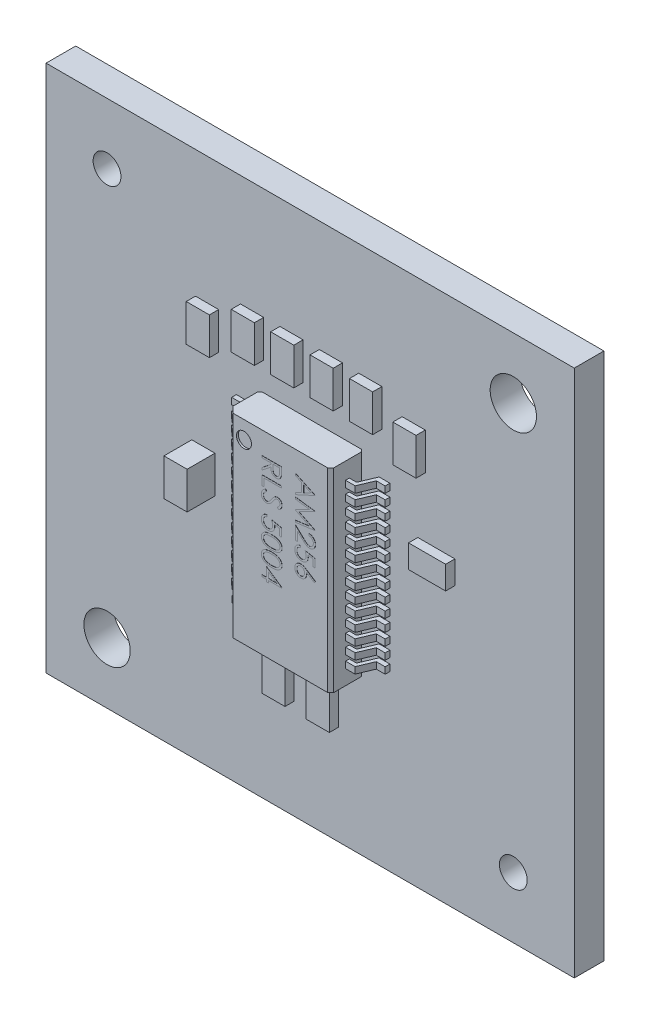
SolidWorks part; units mm, degrees
ref_plane "Plane1" through (0, 0, 0) normal (0, 0, 1) x (1, 0, 0)
ref_plane "Plane2" through (0, 0, 0) normal (0, 1, 0) x (1, 0, 0)
ref_plane "Plane3" through (0, 0, 0) normal (1, 0, 0) x (0, 0, -1)
sketch "Sketch1" plane through (0, 0, 0) normal (0, 0, 1) x (1, 0, 0)
  line L0 (7.9685, 8.8978) -> (9.3019, 8.8978)
  line L1 (7.9685, 9.7978) -> (2.3685, 9.7978)
  line L2 (7.9685, 9.7978) -> (7.9685, 8.8978)
  line L3 (7.9685, -0.7022) -> (2.3685, -0.7022)
  line L4 (2.3685, 9.7978) -> (2.3685, 8.8978)
  line L5 (7.9685, 9.7978) -> (2.3685, -0.7022) construction
  line L6 (7.9685, -0.7022) -> (2.3685, 9.7978) construction
  line L7 (1.0185, 8.8978) -> (2.3685, 8.8978)
  line L8 (1.0185, 8.8978) -> (1.0185, 8.5478)
  line L9 (1.0185, 8.5478) -> (2.3685, 8.5478)
  line L10 (2.3685, 8.5478) -> (2.3685, 8.2478)
  line L11 (7.9685, 8.5478) -> (7.9685, 8.2478)
  line L13 (9.3019, 8.8978) -> (9.3019, 8.5478)
  line L14 (7.9685, 8.5478) -> (9.3019, 8.5478)
  line L16 (7.9685, 7.8978) -> (9.3019, 7.8978)
  line L17 (9.3019, 8.2478) -> (9.3019, 7.8978)
  line L18 (7.9685, 7.5978) -> (9.3019, 7.5978)
  line L19 (7.9685, 7.2478) -> (7.9685, 6.9478)
  line L20 (7.9685, 7.2478) -> (9.3019, 7.2478)
  line L21 (9.3019, 7.5978) -> (9.3019, 7.2478)
  line L22 (7.9685, 6.9478) -> (9.3019, 6.9478)
  line L23 (7.9685, 6.5978) -> (7.9685, 6.2978)
  line L24 (7.9685, 6.5978) -> (9.3019, 6.5978)
  line L25 (9.3019, 6.9478) -> (9.3019, 6.5978)
  line L26 (7.9685, 6.2978) -> (9.3019, 6.2978)
  line L27 (7.9685, 7.8978) -> (7.9685, 7.5978)
  line L28 (7.9685, 5.9478) -> (9.3019, 5.9478)
  line L29 (9.3019, 6.2978) -> (9.3019, 5.9478)
  line L30 (7.9685, 5.6478) -> (9.3019, 5.6478)
  line L31 (7.9685, 5.2978) -> (7.9685, 4.9978)
  line L32 (7.9685, 5.2978) -> (9.3019, 5.2978)
  line L33 (9.3019, 5.6478) -> (9.3019, 5.2978)
  line L34 (7.9685, 4.9978) -> (9.3019, 4.9978)
  line L35 (7.9685, 4.6478) -> (7.9685, 4.3478)
  line L36 (7.9685, 4.6478) -> (9.3019, 4.6478)
  line L37 (9.3019, 4.9978) -> (9.3019, 4.6478)
  line L38 (7.9685, 4.3478) -> (9.3019, 4.3478)
  line L39 (7.9685, 5.9478) -> (7.9685, 5.6478)
  line L40 (7.9685, 3.9978) -> (9.3019, 3.9978)
  line L41 (9.3019, 4.3478) -> (9.3019, 3.9978)
  line L42 (7.9685, 3.6978) -> (9.3019, 3.6978)
  line L43 (7.9685, 3.3478) -> (7.9685, 3.0478)
  line L44 (7.9685, 3.3478) -> (9.3019, 3.3478)
  line L45 (9.3019, 3.6978) -> (9.3019, 3.3478)
  line L46 (7.9685, 3.0478) -> (9.3019, 3.0478)
  line L47 (7.9685, 3.9978) -> (7.9685, 3.6978)
  line L48 (7.9685, 2.6978) -> (9.3019, 2.6978)
  line L49 (9.3019, 3.0478) -> (9.3019, 2.6978)
  line L50 (7.9685, 2.3978) -> (9.3019, 2.3978)
  line L51 (7.9685, 8.2478) -> (9.3019, 8.2478)
  line L52 (7.9685, 2.0478) -> (9.3019, 2.0478)
  line L53 (9.3019, 2.3978) -> (9.3019, 2.0478)
  line L54 (7.9685, 1.7478) -> (9.3019, 1.7478)
  line L55 (7.9685, 0.7478) -> (7.9685, 0.4478)
  line L56 (7.9685, 1.3978) -> (9.3019, 1.3978)
  line L57 (9.3019, 1.7478) -> (9.3019, 1.3978)
  line L58 (7.9685, 1.0978) -> (9.3019, 1.0978)
  line L59 (7.9685, 1.3978) -> (7.9685, 1.0978)
  line L60 (7.9685, 2.0478) -> (7.9685, 1.7478)
  line L61 (9.3019, 1.0978) -> (9.3019, 0.7478)
  line L62 (7.9685, 0.4478) -> (9.3019, 0.4478)
  line L63 (7.9685, 0.0978) -> (7.9685, -0.7022)
  line L64 (7.9685, 0.0978) -> (9.3019, 0.0978)
  line L65 (9.3019, 0.4478) -> (9.3019, 0.0978)
  line L66 (1.0185, 8.2478) -> (2.3685, 8.2478)
  line L67 (1.0185, 8.2478) -> (1.0185, 7.8978)
  line L68 (1.0185, 7.8978) -> (2.3685, 7.8978)
  line L69 (2.3685, 7.8978) -> (2.3685, 7.5978)
  line L70 (1.0185, 7.5978) -> (2.3685, 7.5978)
  line L71 (1.0185, 7.5978) -> (1.0185, 7.2478)
  line L72 (1.0185, 7.2478) -> (2.3685, 7.2478)
  line L73 (2.3685, 7.2478) -> (2.3685, 6.9478)
  line L74 (1.0185, 6.9478) -> (2.3685, 6.9478)
  line L75 (1.0185, 6.9478) -> (1.0185, 6.5978)
  line L76 (1.0185, 6.5978) -> (2.3685, 6.5978)
  line L77 (2.3685, 5.9478) -> (2.3685, 5.6478)
  line L78 (1.0185, 6.2978) -> (2.3685, 6.2978)
  line L79 (1.0185, 6.2978) -> (1.0185, 5.9478)
  line L80 (1.0185, 5.9478) -> (2.3685, 5.9478)
  line L81 (2.3685, 5.2978) -> (2.3685, 4.9978)
  line L82 (1.0185, 5.6478) -> (2.3685, 5.6478)
  line L83 (1.0185, 5.6478) -> (1.0185, 5.2978)
  line L84 (1.0185, 5.2978) -> (2.3685, 5.2978)
  line L85 (2.3685, 4.6478) -> (2.3685, 4.3478)
  line L86 (1.0185, 4.9978) -> (2.3685, 4.9978)
  line L87 (1.0185, 4.9978) -> (1.0185, 4.6478)
  line L88 (1.0185, 4.6478) -> (2.3685, 4.6478)
  line L89 (2.3685, 3.9978) -> (2.3685, 3.6978)
  line L90 (1.0185, 4.3478) -> (2.3685, 4.3478)
  line L91 (1.0185, 4.3478) -> (1.0185, 3.9978)
  line L92 (1.0185, 3.9978) -> (2.3685, 3.9978)
  line L93 (2.3685, 3.3478) -> (2.3685, 3.0478)
  line L94 (1.0185, 3.6978) -> (2.3685, 3.6978)
  line L95 (1.0185, 3.6978) -> (1.0185, 3.3478)
  line L96 (1.0185, 3.3478) -> (2.3685, 3.3478)
  line L97 (2.3685, 2.6978) -> (2.3685, 2.3978)
  line L98 (1.0185, 3.0478) -> (2.3685, 3.0478)
  line L99 (1.0185, 3.0478) -> (1.0185, 2.6978)
  line L100 (1.0185, 2.6978) -> (2.3685, 2.6978)
  line L101 (2.3685, 2.0478) -> (2.3685, 1.7478)
  line L102 (1.0185, 2.3978) -> (2.3685, 2.3978)
  line L103 (1.0185, 2.3978) -> (1.0185, 2.0478)
  line L104 (1.0185, 2.0478) -> (2.3685, 2.0478)
  line L105 (2.3685, 1.3978) -> (2.3685, 1.0978)
  line L106 (1.0185, 1.7478) -> (2.3685, 1.7478)
  line L107 (1.0185, 1.7478) -> (1.0185, 1.3978)
  line L108 (1.0185, 1.3978) -> (2.3685, 1.3978)
  line L109 (2.3685, 0.0978) -> (2.3685, -0.7022)
  line L110 (1.0185, 1.0978) -> (2.3685, 1.0978)
  line L111 (1.0185, 1.0978) -> (1.0185, 0.7478)
  line L112 (1.0185, 0.7478) -> (2.3685, 0.7478)
  line L113 (7.9685, 0.7478) -> (9.3019, 0.7478)
  line L114 (1.0185, 0.4478) -> (2.3685, 0.4478)
  line L115 (1.0185, 0.4478) -> (1.0185, 0.0978)
  line L116 (1.0185, 0.0978) -> (2.3685, 0.0978)
  line L117 (7.9685, 2.6978) -> (7.9685, 2.3978)
  line L118 (2.3685, 6.5978) -> (2.3685, 6.2978)
  line L119 (2.3685, 0.7478) -> (2.3685, 0.4478)
  line L187 (7.4885, 0.4478) -> (7.4885, 0.0978)
  line L188 (7.0185, 0.7478) -> (7.1952, 0.7478)
  line L189 (7.4885, 1.0978) -> (7.4885, 1.079)
  line L190 (7.4885, 1.7478) -> (7.4885, 1.3978)
  line L191 (7.4885, 3.0478) -> (7.4885, 2.6978)
  line L192 (7.4885, 2.3978) -> (7.4885, 2.0478)
  line L193 (7.4885, 3.6978) -> (7.4885, 3.3478)
  line L194 (7.4885, 4.3478) -> (7.4885, 3.9978)
  line L195 (7.4885, 4.9978) -> (7.4885, 4.6478)
  line L196 (7.4885, 5.6478) -> (7.4885, 5.2978)
  line L197 (7.4885, 6.2978) -> (7.4885, 5.9478)
  line L198 (7.4885, 6.9478) -> (7.4885, 6.5978)
  line L199 (7.4885, 7.5978) -> (7.4885, 7.2478)
  line L200 (7.0185, 8.2478) -> (7.1418, 8.2478)
  line L201 (7.4885, 8.0165) -> (7.4885, 7.8978)
  line L202 (7.0185, 8.5478) -> (7.3018, 8.5478)
  line L203 (7.4885, 8.8978) -> (7.4885, 8.5478)
  circle A0 centre (5.1685, 4.5478) radius 0.005
  dimension "D3" = 1.35
  dimension "D1" = 5.6
  dimension "D2" = 10.5
  dimension "D4" = 0.9
  dimension "D5" = 0.35
  dimension "D6" = 2
  dimension "D7" = 14
extrude "Base-Extrude" add sketch "Sketch1" along normal blind 1.86
sketch "Sketch5" plane through (0, 0, 1.86) normal (0, 0, 1) x (1, 0, 0)
  circle A0 centre (3.2885, 8.8458) radius 0.4042
extrude "Cut-Extrude5" cut sketch "Sketch5" against normal blind 0.1
sketch "Sketch15" plane through (0, 9.7978, 0) normal (0, 1, 0) x (1, 0, 0)
  line L0 (1.0185, -0.2554) -> (1.515, -0.2554)
  line L1 (1.0185, -1.86) -> (1.0185, 0) construction
  line L2 (1.515, -0.2554) -> (1.8543, -1.0602)
  line L3 (1.8543, -1.0602) -> (2.3685, -1.0602)
  line L4 (2.3685, -1.86) -> (2.3685, 0) construction
  line L5 (1.6176, 0) -> (1.9784, -0.8559)
  line L6 (2.3685, 0) -> (1.0185, 0) construction
  line L7 (1.9784, -0.8559) -> (2.3685, -0.8559)
  line L8 (2.3685, -0.8559) -> (2.3685, -0.1875)
  line L9 (2.3685, -1.86) -> (2.3685, 0) construction
  line L10 (2.3685, -0.1875) -> (2.4855, -0.0818)
  line L11 (2.4855, -0.0818) -> (7.8515, -0.0818)
  line L13 (7.9685, -1.86) -> (2.3685, -1.86) construction
  line L14 (2.3685, -1.0602) -> (2.3685, -1.5336)
  line L15 (1.0185, -0.2554) -> (0.5525, -0.2554)
  line L16 (0.5525, -0.2554) -> (0.5525, -2.3857)
  line L17 (0.5525, -2.3857) -> (2.6512, -2.3857)
  line L18 (9.7846, -2.3857) -> (7.7471, -2.3896)
  line L19 (9.7846, -0.2554) -> (9.7846, -2.3857)
  line L21 (7.9685, -1.0602) -> (7.9685, -1.6968)
  line L22 (7.9685, -0.1875) -> (7.8515, -0.0818)
  line L23 (7.9685, -0.8559) -> (7.9685, -0.1875)
  line L24 (8.3586, -0.8559) -> (7.9685, -0.8559)
  line L25 (8.7194, 0) -> (8.3586, -0.8559)
  line L26 (8.4827, -1.0602) -> (7.9685, -1.0602)
  line L27 (8.822, -0.2554) -> (8.4827, -1.0602)
  line L28 (9.7846, -0.2554) -> (8.822, -0.2554)
  line L29 (1.6176, 0) -> (8.7194, 0)
  line L30 (2.3685, -1.5336) -> (2.7064, -1.86)
  line L31 (2.7064, -1.86) -> (2.6512, -2.3857)
  line L33 (7.9685, -1.86) -> (7.9685, 0) construction
  line L34 (7.9685, -1.6968) -> (7.8028, -1.86)
  line L35 (7.8028, -1.86) -> (7.7471, -2.3896)
extrude "Cut-Extrude9" cut sketch "Sketch15" against normal blind 11
sketch "Sketch6" plane through (0, 0, 1.86) normal (0, 0, 1) x (1, 0, 0)
  line L0 (6.0658, 8.7382) -> (6.0658, 0.6216) construction
  text T0 "AM256  RLS 5004" font "Century Gothic" height in points 4
extrude "Boss-Extrude1" add sketch "Sketch6" along normal blind 0.01
sketch "Sketch7" plane through (0, 0, 0) normal (0, 0, -1) x (-1, 0, 0)
  line L0 (-15, 5.0018) -> (5, 5.0018) construction
  line L1 (-5, 5.0018) -> (-5, 19.2518) construction
  line L2 (-19.25, 19.2518) -> (9.25, 19.2518)
  line L3 (-19.25, 19.2518) -> (-19.25, -9.2482)
  line L4 (-19.25, -9.2482) -> (9.25, -9.2482)
  line L5 (9.25, 19.2518) -> (9.25, -9.2482)
  line L6 (-5, 5.0018) -> (9.25, 5.0018) construction
  line L7 (-19.25, 19.2518) -> (9.25, -9.2482) construction
  line L8 (-19.25, -9.2482) -> (9.25, 19.2518) construction
  circle A0 centre (-5, 5.0018) radius 10 construction
  circle A1 centre (-13.5, 5.0018) radius 0.8 construction
  circle A2 centre (3.5, 5.0018) radius 0.8 construction
  circle A3 centre (-5, 5.0018) radius 15.5 construction
  circle A4 centre (-15.9602, 15.9619) radius 1.25
  circle A5 centre (5.9602, 15.9619) radius 1.25 construction
  circle A6 centre (5.9602, -5.9584) radius 1.25
  circle A7 centre (-15.9602, -5.9584) radius 1.25 construction
  circle A8 centre (5.9602, 15.9619) radius 0.75
  circle A9 centre (-15.9602, -5.9584) radius 0.75
  dimension "D1" = 2.5
  dimension "D2" = 4
  dimension "D3" = 0.5
  dimension "D4" = 0.5
  dimension "D6" = 28.5
  dimension "D7" = 28.5
extrude "Extrude1" add sketch "Sketch7" along normal blind 1.6
sketch "Sketch14" plane through (0, 0, -1.6) normal (0, 0, -1) x (-1, 0, 0)
  line L0 (-19.25, -9.2482) -> (9.25, -9.2482) construction
  line L1 (-1.55, 1.1518) -> (1.95, 1.1518)
  line L2 (-1.55, 1.1518) -> (-1.55, -0.4482)
  line L3 (-1.55, -0.4482) -> (1.95, -0.4482)
  line L4 (1.95, 1.1518) -> (1.95, -0.4482)
  line L5 (9.25, -9.2482) -> (9.25, 19.2518) construction
  line L6 (-1.55, 3.7518) -> (1.95, 3.7518)
  line L7 (-1.55, 3.7518) -> (-1.55, 2.1518)
  line L8 (-1.55, 2.1518) -> (1.95, 2.1518)
  line L9 (1.95, 3.7518) -> (1.95, 2.1518)
  line L10 (-1.55, 6.3518) -> (1.95, 6.3518)
  line L11 (-1.55, 6.3518) -> (-1.55, 4.7518)
  line L12 (-1.55, 4.7518) -> (1.95, 4.7518)
  line L13 (1.95, 6.3518) -> (1.95, 4.7518)
  line L14 (-1.55, 8.9518) -> (1.95, 8.9518)
  line L15 (-1.55, 8.9518) -> (-1.55, 7.3518)
  line L16 (-1.55, 7.3518) -> (1.95, 7.3518)
  line L17 (1.95, 8.9518) -> (1.95, 7.3518)
  line L18 (-5.0398, -0.0584) -> (-5.0398, -1.2584) construction
  line L19 (-5.6398, -0.0584) -> (-4.4398, -0.0584)
  line L20 (-5.6398, -0.0584) -> (-5.6398, -1.2584)
  line L21 (-5.6398, -1.2584) -> (-4.4398, -1.2584)
  line L22 (-4.4398, -0.0584) -> (-4.4398, -1.2584)
  line L23 (-5.6398, -0.6584) -> (-4.4398, -0.6584) construction
  line L24 (-5.6398, 2.4816) -> (-4.4398, 2.4816)
  line L25 (-5.6398, 2.4816) -> (-5.6398, 1.2816)
  line L26 (-5.6398, 1.2816) -> (-4.4398, 1.2816)
  line L27 (-4.4398, 2.4816) -> (-4.4398, 1.2816)
  line L28 (-5.0398, 2.4816) -> (-5.0398, 1.2816) construction
  line L29 (-5.6398, 1.8816) -> (-4.4398, 1.8816) construction
  line L30 (-17.6362, 1.6839) -> (-16.4362, 1.6839)
  line L31 (-17.6362, 1.6839) -> (-17.6362, 0.4839)
  line L32 (-17.6362, 0.4839) -> (-16.4362, 0.4839)
  line L33 (-16.4362, 1.6839) -> (-16.4362, 0.4839)
  line L34 (-17.0362, 1.6839) -> (-17.0362, 0.4839) construction
  line L35 (-17.6362, 1.0839) -> (-16.4362, 1.0839) construction
  line L36 (-10.6398, -0.0584) -> (-9.4398, -0.0584)
  line L37 (-10.6398, -0.0584) -> (-10.6398, -1.2584)
  line L38 (-10.6398, -1.2584) -> (-9.4398, -1.2584)
  line L39 (-9.4398, -0.0584) -> (-9.4398, -1.2584)
  line L40 (-10.0398, -0.0584) -> (-10.0398, -1.2584) construction
  line L41 (-10.6398, -0.6584) -> (-9.4398, -0.6584) construction
  line L42 (-13.1398, -0.0584) -> (-11.9398, -0.0584)
  line L43 (-13.1398, -0.0584) -> (-13.1398, -1.2584)
  line L44 (-13.1398, -1.2584) -> (-11.9398, -1.2584)
  line L45 (-11.9398, -0.0584) -> (-11.9398, -1.2584)
  line L46 (-12.5398, -0.0584) -> (-12.5398, -1.2584) construction
  line L47 (-13.1398, -0.6584) -> (-11.9398, -0.6584) construction
  line L48 (-15.6398, -0.0584) -> (-14.4398, -0.0584)
  line L49 (-15.6398, -0.0584) -> (-15.6398, -1.2584)
  line L50 (-15.6398, -1.2584) -> (-14.4398, -1.2584)
  line L51 (-14.4398, -0.0584) -> (-14.4398, -1.2584)
  line L52 (-15.0398, -0.0584) -> (-15.0398, -1.2584) construction
  line L53 (-15.6398, -0.6584) -> (-14.4398, -0.6584) construction
  line L54 (-8.1398, -0.0584) -> (-6.9398, -0.0584)
  line L55 (-8.1398, -0.0584) -> (-8.1398, -1.2584)
  line L56 (-8.1398, -1.2584) -> (-6.9398, -1.2584)
  line L57 (-6.9398, -0.0584) -> (-6.9398, -1.2584)
  line L58 (-7.5398, -0.0584) -> (-7.5398, -1.2584) construction
  line L59 (-8.1398, -0.6584) -> (-6.9398, -0.6584) construction
  line L60 (-17.6362, 4.2239) -> (-16.4362, 4.2239)
  line L61 (-17.6362, 4.2239) -> (-17.6362, 3.0239)
  line L62 (-17.6362, 3.0239) -> (-16.4362, 3.0239)
  line L63 (-16.4362, 4.2239) -> (-16.4362, 3.0239)
  line L64 (-17.0362, 4.2239) -> (-17.0362, 3.0239) construction
  line L65 (-17.6362, 3.6239) -> (-16.4362, 3.6239) construction
  circle A0 centre (5.9602, -5.9584) radius 1.25 construction
  point P30 (-5.0398, -0.6584)
  dimension "D8" = 11
  dimension "D1" = 8.8
  dimension "D2" = 7.3
  dimension "D3" = 1.6
  dimension "D4" = 3.5
  dimension "D6" = 2.6
  dimension "D7" = 1.2
  dimension "D9" = 5.3
  dimension "D11" = 2.54
  dimension "D13" = 5
  dimension "D14" = 1.9964
  dimension "D15" = 1.7423
  dimension "D5" = 4
  dimension "D10" = 2
  dimension "D12" = 5
  dimension "D16" = 2
extrude "Boss-Extrude2" add sketch "Sketch14" along normal blind 0.05
sketch "Sketch12" plane through (0, 0, 0) normal (0, 0, 1) x (1, 0, 0)
  line L0 (5.2835, -1.8857) -> (6.5335, -1.8857)
  line L1 (5.2835, -1.8857) -> (5.2835, -3.8857)
  line L2 (5.2835, -3.8857) -> (6.5335, -3.8857)
  line L3 (6.5335, -1.8857) -> (6.5335, -3.8857)
  line L4 (10.8087, 7.1145) -> (12.8087, 7.1145)
  line L5 (10.8087, 7.1145) -> (10.8087, 5.8645)
  line L6 (10.8087, 5.8645) -> (12.8087, 5.8645)
  line L7 (12.8087, 7.1145) -> (12.8087, 5.8645)
  line L8 (-1.1872, 12.3939) -> (0.0628, 12.3939)
  line L9 (-1.1872, 12.3939) -> (-1.1872, 10.3939)
  line L10 (-1.1872, 10.3939) -> (0.0628, 10.3939)
  line L11 (0.0628, 12.3939) -> (0.0628, 10.3939)
  line L12 (1.2407, 13.2415) -> (2.4907, 13.2415)
  line L13 (1.2407, 13.2415) -> (1.2407, 11.2415)
  line L14 (1.2407, 11.2415) -> (2.4907, 11.2415)
  line L15 (2.4907, 13.2415) -> (2.4907, 11.2415)
  line L16 (2.8906, -1.8673) -> (4.1406, -1.8673)
  line L17 (2.8906, -1.8673) -> (2.8906, -3.8673)
  line L18 (2.8906, -3.8673) -> (4.1406, -3.8673)
  line L19 (4.1406, -1.8673) -> (4.1406, -3.8673)
  line L20 (-1.3881, 5.5808) -> (-0.1381, 5.5808)
  line L21 (-1.3881, 5.5808) -> (-1.3881, 3.5808)
  line L22 (-1.3881, 3.5808) -> (-0.1381, 3.5808)
  line L23 (-0.1381, 5.5808) -> (-0.1381, 3.5808)
  line L24 (3.3669, 13.2558) -> (4.6169, 13.2558)
  line L25 (3.3669, 13.2558) -> (3.3669, 11.2558)
  line L26 (3.3669, 11.2558) -> (4.6169, 11.2558)
  line L27 (4.6169, 13.2558) -> (4.6169, 11.2558)
  line L28 (5.4931, 13.2415) -> (6.7431, 13.2415)
  line L29 (5.4931, 13.2415) -> (5.4931, 11.2415)
  line L30 (5.4931, 11.2415) -> (6.7431, 11.2415)
  line L31 (6.7431, 13.2415) -> (6.7431, 11.2415)
  line L32 (7.6193, 13.1984) -> (8.8693, 13.1984)
  line L33 (7.6193, 13.1984) -> (7.6193, 11.1984)
  line L34 (7.6193, 11.1984) -> (8.8693, 11.1984)
  line L35 (8.8693, 13.1984) -> (8.8693, 11.1984)
  line L36 (9.961, 12.3364) -> (11.211, 12.3364)
  line L37 (9.961, 12.3364) -> (9.961, 10.3364)
  line L38 (9.961, 10.3364) -> (11.211, 10.3364)
  line L39 (11.211, 12.3364) -> (11.211, 10.3364)
extrude "Extrude6" add sketch "Sketch12" along normal blind 0.5
sketch "Sketch18" plane through (0, 0, 0.5) normal (0, 0, 1) x (1, 0, 0)
  line L8 (-1.3881, 5.5808) -> (-1.3881, 3.5808)
  line L9 (-1.3881, 3.5808) -> (-0.1381, 3.5808)
  line L10 (-0.1381, 3.5808) -> (-0.1381, 5.5808)
  line L11 (-0.1381, 5.5808) -> (-1.3881, 5.5808)
  line L12 (-1.3881, 5.5808) -> (-1.3881, 3.5808)
  line L13 (-1.3881, 3.5808) -> (-0.1381, 3.5808)
  line L14 (-0.1381, 3.5808) -> (-0.1381, 5.5808)
  line L15 (-0.1381, 5.5808) -> (-1.3881, 5.5808)
  dimension "D1" = 0
extrude "Boss-Extrude4" add sketch "Sketch18" along normal blind 1
equation "\"1.8¸6\"=1.8"
equation "\"¸1.25\"=0.876516"
